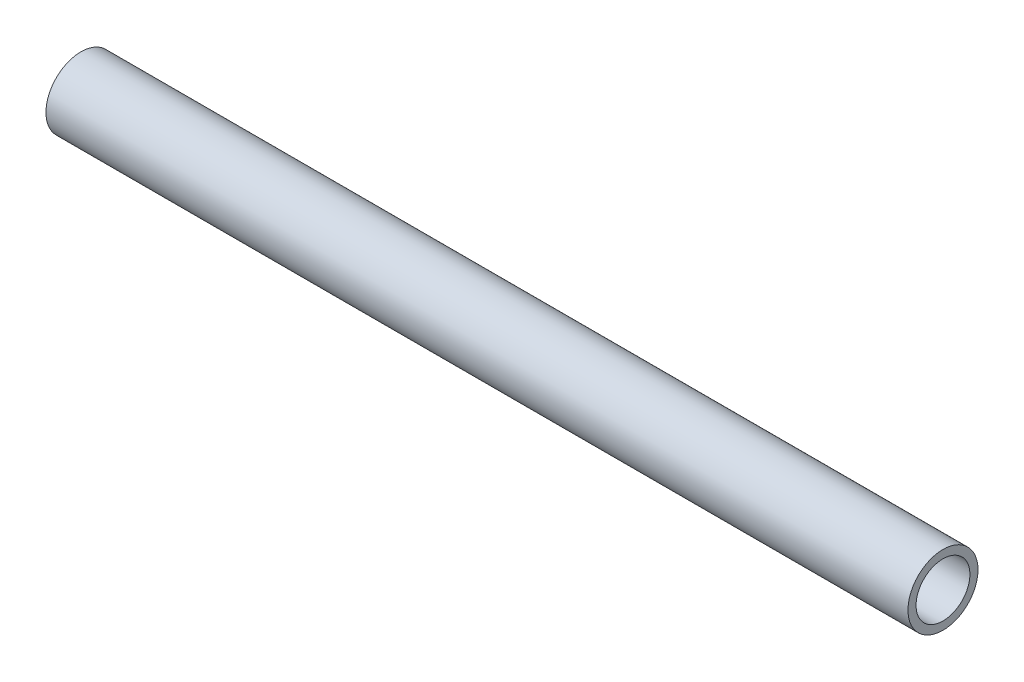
SolidWorks part; units mm, degrees
ref_plane "Front" through (0, 0, 0) normal (0, 0, 1) x (1, 0, 0)
ref_plane "Top" through (0, 0, 0) normal (0, 1, 0) x (1, 0, 0)
ref_plane "Right" through (0, 0, 0) normal (1, 0, 0) x (0, 0, -1)
sketch "Sketch1" plane through (0, 0, 0) normal (0, 0, 1) x (1, 0, 0)
  line L0 (0, 0) -> (406.4, 0)
  line L1 (9.9848, 0) -> (-9.9848, 0) construction
  dimension "D1" = 406.4
other "Structural Member1"
ref_plane "Plane1" through (0, 0, 0) normal (1, 0, 0) x (0, 0, -1)
sketch "Sketch11" plane through (0, 0, 0) normal (1, 0, 0) x (0, 0, -1)
  circle A0 centre (0, 0) radius 12.7
  circle A1 centre (0, 0) radius 16.51
  point P3 (0, 0)
  dimension "D1" = 33.02
  dimension "D2" = 25.4
